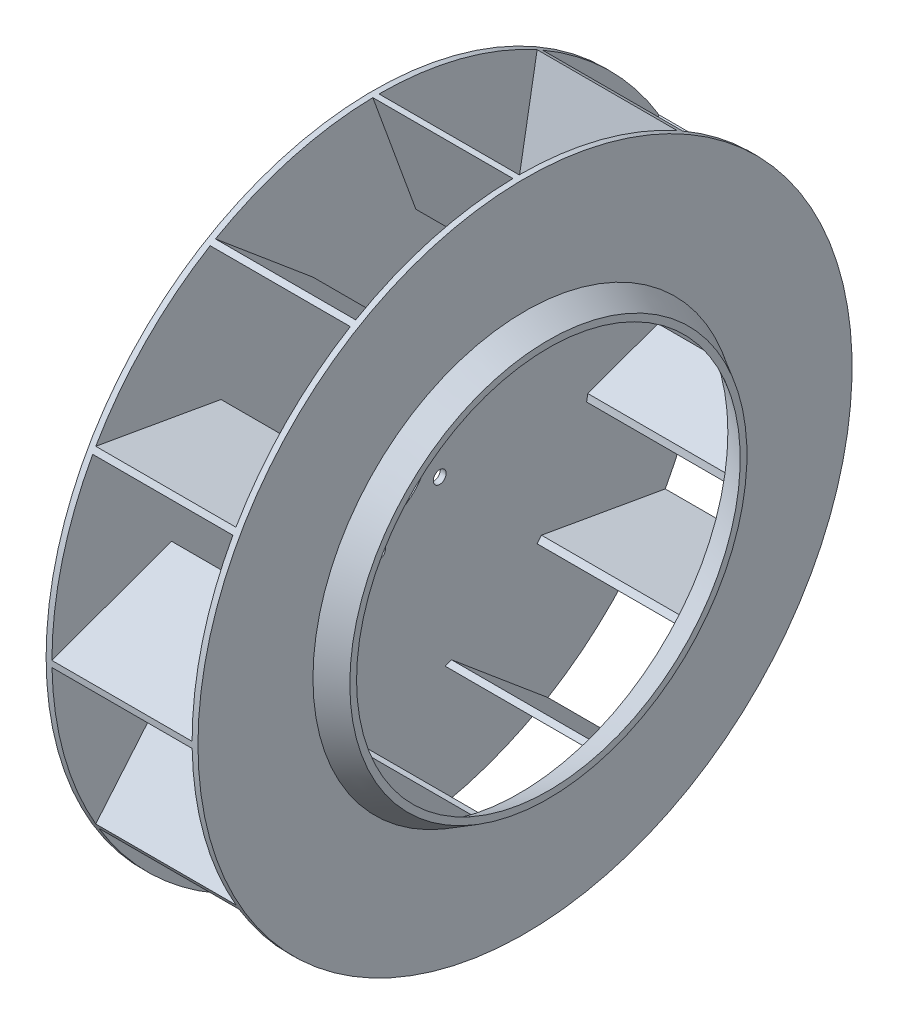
SolidWorks part; units mm, degrees
ref_plane "前视基准面" through (0, 0, 0) normal (0, 0, 1) x (1, 0, 0)
ref_plane "上视基准面" through (0, 0, 0) normal (0, 1, 0) x (1, 0, 0)
ref_plane "右视基准面" through (0, 0, 0) normal (1, 0, 0) x (0, 0, -1)
sketch "草图3" plane through (0, 0, 0) normal (0, 0, 1) x (1, 0, 0)
  line L0 (55, 181.547) -> (75, 170)
  line L1 (-75, 280) -> (55, 280)
  line L2 (-75, 280) -> (-75, 0)
  line L3 (-75, 0) -> (75, 0)
  line L4 (55, 280) -> (55, 181.547)
  line L5 (75, 170) -> (75, 0)
  dimension "D1" = 130
  dimension "D2" = 280
  dimension "D3" = 60
  dimension "D4" = 170
  dimension "D5" = 150
revolve "旋转1" add sketch "草图3" angle 360 about L3
shell "抽壳2" thickness 5
sketch "草图4" plane through (0, 0, 0) normal (0, 0, 1) x (1, 0, 0)
  line L0 (-75, 280) -> (-75, -280) construction
  line L1 (-70, 287.6606) -> (50, 287.6606)
  line L2 (-70, 287.6606) -> (-70, -313.3828)
  line L3 (-70, -313.3828) -> (50, -313.3828)
  line L4 (50, 287.6606) -> (50, -313.3828)
  line L5 (55, -280) -> (55, 280) construction
  dimension "D1" = 5
  dimension "D2" = 5
extrude "拉伸2" cut sketch "草图4" against normal through all and the other way through all
sketch "草图5" plane through (-70, 0, 0) normal (1, 0, 0) x (0, 0, -1)
  line L0 (0, 280) -> (37.239, 177.6867)
  line L1 (0, 0) -> (0, 335.6754) construction
  line L2 (-5.3026, 279.9498) -> (31.5164, 178.7905)
  line L3 (-4.6985, 278.2899) -> (32.5405, 175.9766) construction
  circle A0 centre (0, 0) radius 280 construction
  circle A1 centre (0, 0) radius 181.547 construction
  arc A2 (37.239, 177.6867) -> (31.5164, 178.7905) centre (0, 0) ccw
  arc A3 (0, 280) -> (-5.3026, 279.9498) centre (0, 0) ccw
  dimension "D1" = 20
  dimension "D2" = 5
extrude "拉伸3" add sketch "草图5" along normal up to surface (120 mm away)
pattern_circular "阵列(圆周)3" count 12 over 360 about axis through (0, 0, 0) along (1, 0, 0) of "拉伸3"
sketch "草图7" plane through (-70, 0, 0) normal (1, 0, 0) x (0, 0, -1)
  circle A0 centre (0, 0) radius 42.5
  dimension "D1" = 85
extrude "拉伸4" cut sketch "草图7" against normal through all
hole_wizard "孔1" positions "草图9" profile "草图8" legacy
sketch "草图9" plane through (-70, 0, 0) normal (1, 0, 0) x (0, 0, -1)
  point P0 (0, 60)
  dimension "D1" = 60
sketch "草图8" plane through (-70, 60, 0) normal (0, 1, 0) x (0, 0, -1)
  line L0 (0, 0) -> (0, 5)
  line L1 (0, 5) -> (5.5, 5)
  line L2 (5.5, 5) -> (5.5, 0)
  line L3 (5.5, 0) -> (0, 0)
  line L4 (0, 110) -> (0, -10) construction
  dimension "直径" = 11
  dimension "深度" = 5
pattern_circular "阵列(圆周)4" count 6 over 360 about axis through (0, 0, 0) along (1, 0, 0) of "孔1"
